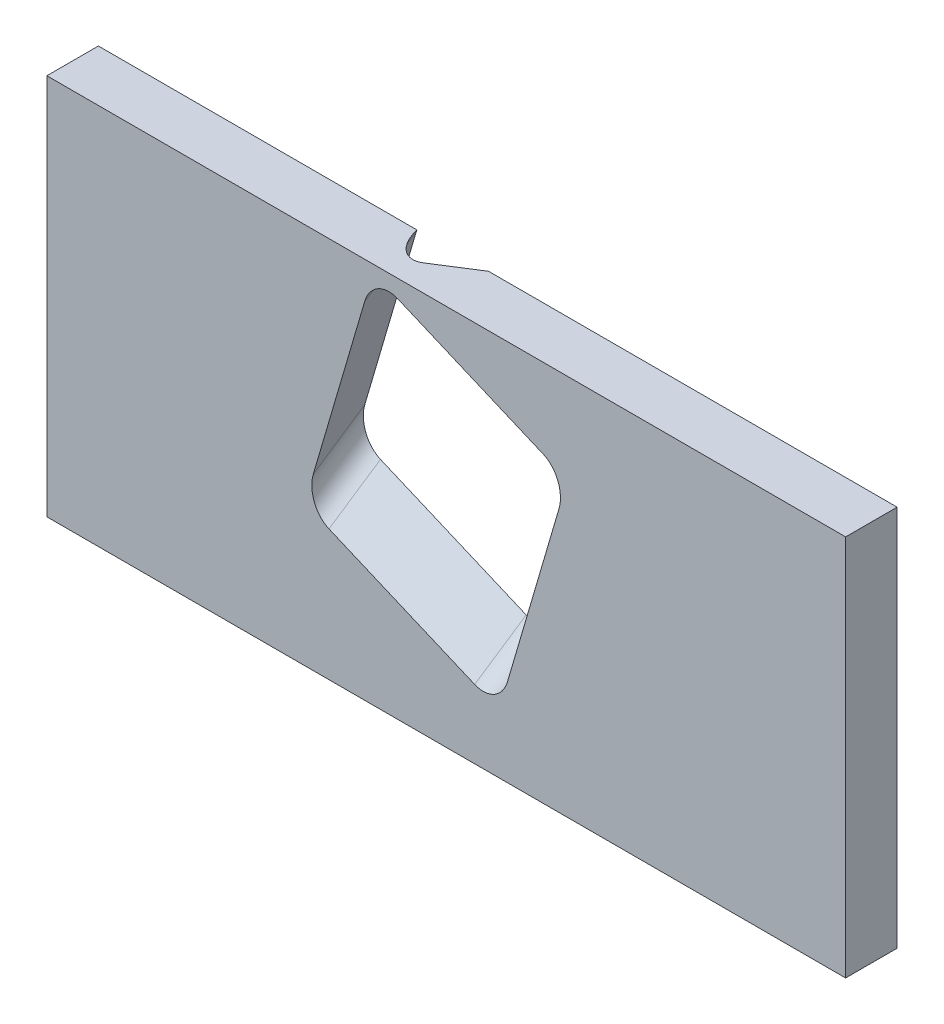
SolidWorks part; units mm, degrees
ref_plane "Ebene vorne" through (0, 0, 0) normal (0, 0, 1) x (1, 0, 0)
ref_plane "Ebene oben" through (0, 0, 0) normal (0, 1, 0) x (1, 0, 0)
ref_plane "Ebene rechts" through (0, 0, 0) normal (1, 0, 0) x (0, 0, -1)
sketch "Skizze1" plane through (0, 0, 0) normal (0, 0, 1) x (1, 0, 0)
  line L1 (-37.7894, 88.7718) -> (39.7561, 88.7718)
  line L2 (-37.7894, 88.7718) -> (-37.7894, 51.6848)
  line L3 (-37.7894, 51.6848) -> (39.7561, 51.6848)
  line L4 (39.7561, 88.7718) -> (39.7561, 51.6848)
extrude "Linear austragen1" add sketch "Skizze1" along normal blind 5
other "Formnest1" parameters "Dicke"=3
other "ROHR<2>@Baugruppe21"
equation "\"Radius\"=0"
equation "\"Stückzahl\"= 1"
